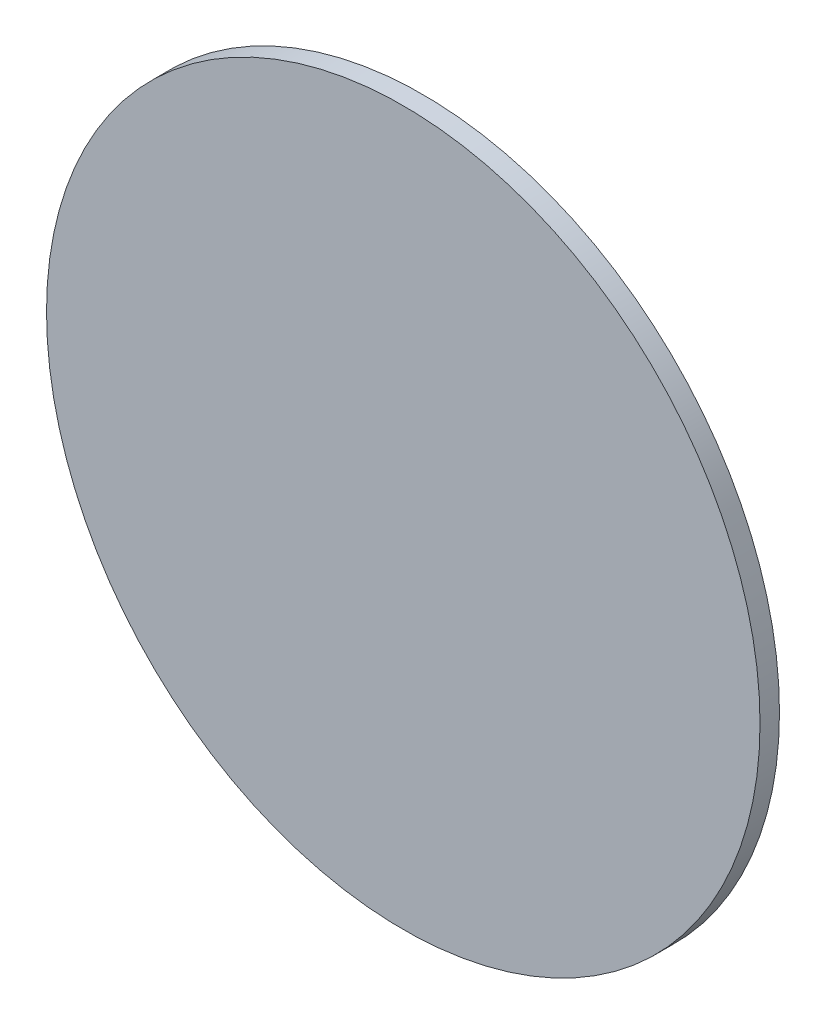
SolidWorks part; units mm, degrees
ref_plane "Plan de face" through (0, 0, 0) normal (0, 0, 1) x (1, 0, 0)
ref_plane "Plan de dessus" through (0, 0, 0) normal (0, 1, 0) x (1, 0, 0)
ref_plane "Plan de droite" through (0, 0, 0) normal (1, 0, 0) x (0, 0, -1)
sketch "Esquisse1" plane through (0, 0, 0) normal (0, 0, 1) x (1, 0, 0)
  line L0 (0.5971, -0.6049) -> (44.7134, 24.9891) construction
  line L1 (0.5971, -0.6049) -> (0.6425, -50.9448) construction
  line L2 (0.5971, -0.6049) -> (-41.9794, 24.0455) construction
  circle A0 centre (0.5971, -0.6049) radius 50.2717 construction
  arc A1 (0.555, 49.4563) -> (-18.9086, 25.4698) centre (22.2432, 11.9676) ccw
  arc A2 (0.555, 49.4563) -> (-30.4632, 17.378) centre (12.8463, 6.5354) ccw
  arc A3 (-42.6934, -25.578) -> (-12.1729, -30.4417) centre (-21.0671, 11.9379) ccw
  arc A4 (-42.6934, -25.578) -> (0.6294, -36.4066) centre (-11.6572, 6.5142) ccw
  arc A5 (43.9061, -25.5358) -> (32.8734, 3.3232) centre (0.6064, -25.5508) ccw
  arc A6 (43.9061, -25.5358) -> (31.6391, 17.4041) centre (0.6014, -14.6849) ccw
  circle A7 centre (0.5971, -0.6049) radius 55
  arc A8 (-30.4632, 17.378) -> (-42.6986, -25.5543) centre (0.6014, -14.6849) ccw
  arc A9 (-31.6823, 3.299) -> (-42.6934, -25.578) centre (0.6064, -25.5508) ccw
  arc A10 (20.0588, 25.4953) -> (-18.9086, 25.4698) centre (0.6014, -14.6849) ccw
  arc A11 (22.2358, 11.9597) -> (-21.0671, 11.9343) centre (0.6064, -25.5508) ccw
  arc A12 (13.4061, -30.4316) -> (43.9061, -25.5358) centre (22.2432, 11.9676) ccw
  arc A13 (0.6294, -36.4066) -> (43.9061, -25.5358) centre (12.8463, 6.5354) ccw
  arc A14 (0.6064, -25.5508) -> (22.2358, 11.9488) centre (-21.0671, 11.9379) ccw
  arc A15 (13.4061, -30.4316) -> (32.8734, 3.3232) centre (-11.6572, 6.5142) ccw
  arc A16 (-31.6823, 3.299) -> (-12.1729, -30.4417) centre (12.8463, 6.5354) ccw
  arc A17 (-21.0671, 11.9379) -> (0.6196, -25.5584) centre (22.2432, 11.9676) ccw
  arc A18 (31.6391, 17.4041) -> (0.555, 49.4563) centre (-11.6572, 6.5142) ccw
  arc A19 (20.0588, 25.4953) -> (0.555, 49.4563) centre (-21.0671, 11.9379) ccw
  point P2 (0.555, 49.4563)
  point P4 (22.2358, 11.9597)
  point P5 (0.6064, -25.5508)
  point P6 (44.0518, 24.3939)
  point P7 (44.0955, -25.8067)
  point P8 (0.6425, -50.9448)
  point P9 (-42.8543, -25.8824)
  point P10 (-42.8981, 24.3181)
  point P11 (0.5987, -0.7443)
  point P12 (-21.6501, 12.5)
  point P14 (-12.2364, 7.0649)
  point P15 (12.2361, 7.0649)
  point P21 (0, 0)
  point P28 (0, 0)
  point P30 (0.0003, -14.1292)
  point P31 (0, 0)
  point P35 (0, 0)
  point P38 (0, 0)
  point P47 (0, 0)
  point P49 (0, 0)
  point P52 (0, 0)
  point P53 (0, 0)
  point P54 (0, 0)
  point P55 (0, 0)
  point P56 (0, 0)
  point P57 (0, 0)
  point P58 (0, 0)
  point P59 (0, 0)
  dimension "D1" = 6
  dimension "D2" = 2
extrude "Boss.-Extru.1" add sketch "Esquisse1" along normal blind 3 contours A7
